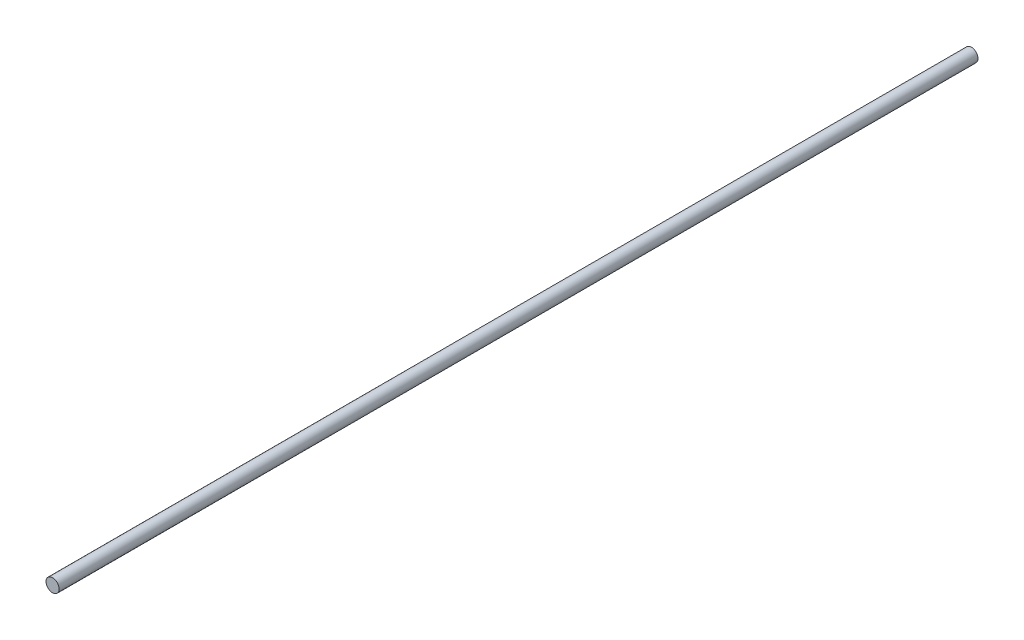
SolidWorks part; units mm, degrees
ref_plane "Front Plane" through (0, 0, 0) normal (0, 0, 1) x (1, 0, 0)
ref_plane "Top Plane" through (0, 0, 0) normal (0, 1, 0) x (1, 0, 0)
ref_plane "Right Plane" through (0, 0, 0) normal (1, 0, 0) x (0, 0, -1)
sketch "Sketch1" plane through (0, 0, 0) normal (0, 0, 1) x (1, 0, 0)
  circle A0 centre (0, 0) radius 30
  dimension "D1" = 60
extrude "Boss-Extrude1" add sketch "Sketch1" against normal blind 4200
